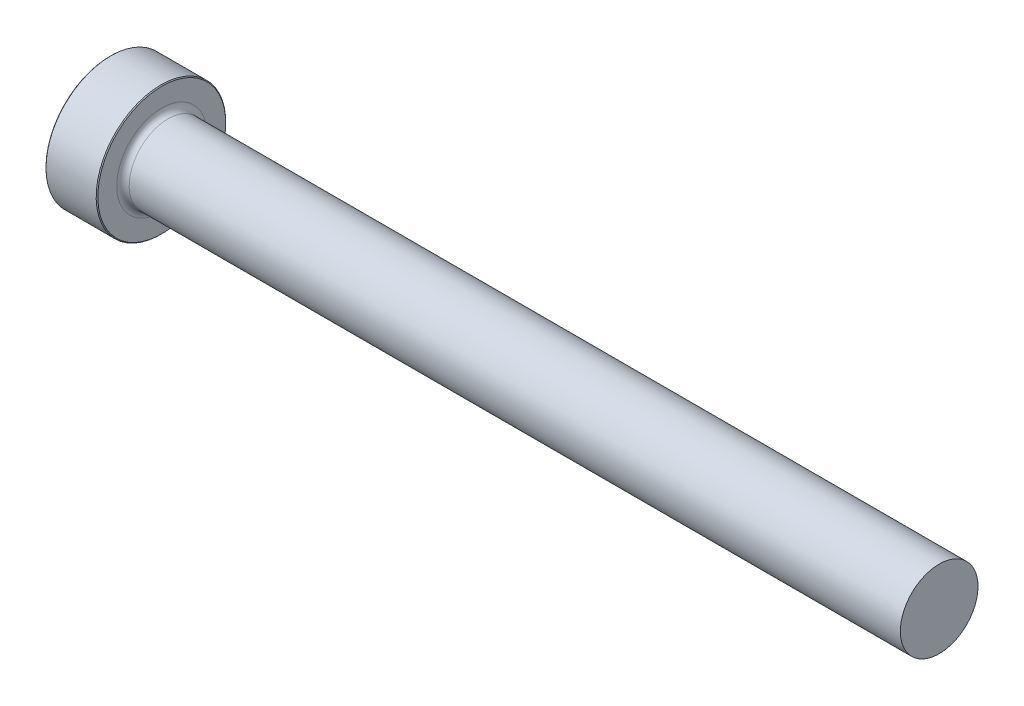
SolidWorks part; units mm, degrees
ref_plane "Front Plane" through (0, 0, 0) normal (0, 0, 1) x (1, 0, 0)
ref_plane "Top Plane" through (0, 0, 0) normal (0, 1, 0) x (1, 0, 0)
ref_plane "Right Plane" through (0, 0, 0) normal (1, 0, 0) x (0, 0, -1)
sketch "Sketch1" plane through (0, 0, 0) normal (0, 0, 1) x (1, 0, 0)
  line L0 (0, 0) -> (0, 7.9375)
  line L1 (0, 7.9375) -> (6.35, 7.9375)
  line L2 (6.35, 7.9375) -> (6.35, 5.5207)
  line L3 (7.112, 4.7587) -> (101.6, 4.7587)
  line L4 (101.6, 4.7587) -> (101.6, 0)
  line L5 (101.6, 0) -> (0, 0)
  line L6 (101.6, 0) -> (101.6, -4.7587) construction
  line L7 (101.6, -4.7587) -> (6.35, -4.7587) construction
  line L8 (0, 0) -> (0, -7.9375) construction
  line L9 (0, -7.9375) -> (6.35, -7.9375) construction
  line L10 (6.35, -7.9375) -> (6.35, -4.7587) construction
  arc A0 (6.35, 5.5207) -> (7.112, 4.7587) centre (7.112, 5.5207) ccw
  dimension "D4" = 0.762
  dimension "L" = 101.6
  dimension "D" = 9.5174
  dimension "H" = 15.875
  dimension "T" = 6.35
revolve "Revolve1" add sketch "Sketch1" angle 360 about L5
chamfer "Chamfer1" distance 0.1016 angle 45 2 edges at (0, 7.9375, 0) (6.35, 7.9375, 0)
